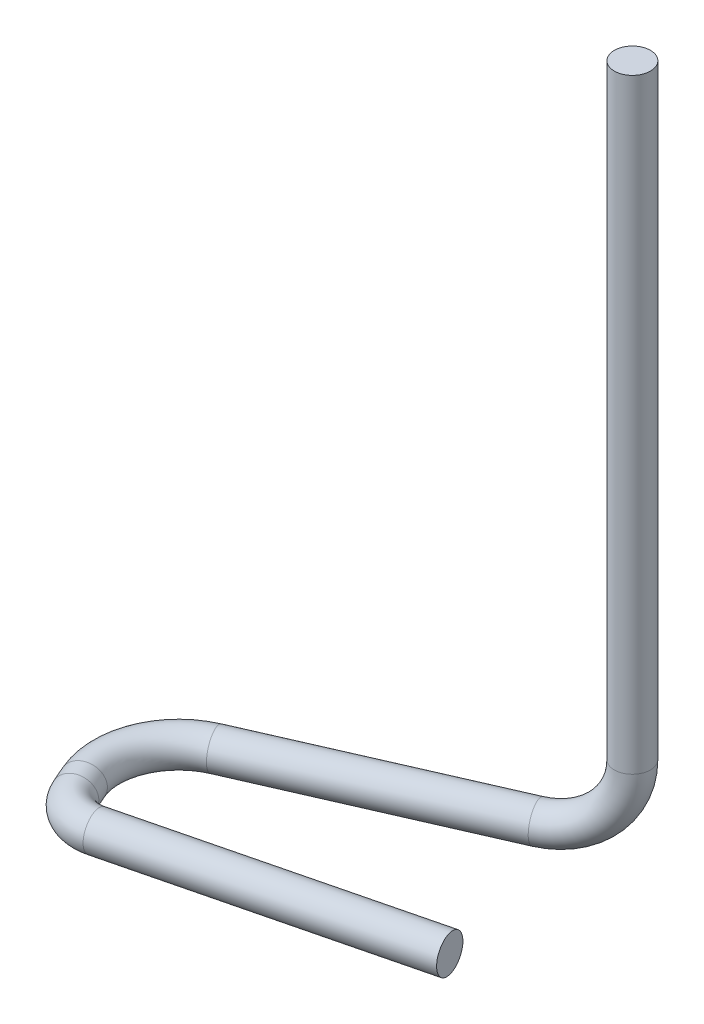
SolidWorks part; units mm, degrees
ref_plane "Plan de face" through (0, 0, 0) normal (0, 0, 1) x (1, 0, 0)
ref_plane "Plan de dessus" through (0, 0, 0) normal (0, 1, 0) x (1, 0, 0)
ref_plane "Plan de droite" through (0, 0, 0) normal (1, 0, 0) x (0, 0, -1)
sketch3d "Esquisse3D1"
  line L0 (4.5267, 6, 9.1161) -> (4.5267, -2.4, 9.1161)
  line L2 (3.6106, -3.4, 9.517) -> (0.5043, -3.4, 10.8762)
  line L3 (-0.0109, -3.4, 12.1932) -> (0.0821, -3.4, 12.4057)
  line L4 (0.6604, -3.4, 12.6906) -> (4.5922, -3.4, 11.7162)
  arc A0 (0.5043, -3.4, 10.8762) -> (-0.0109, -3.4, 12.1932) centre (0.9052, -3.4, 11.7923) ccw
  arc A1 (0.0821, -3.4, 12.4057) -> (0.6604, -3.4, 12.6906) centre (0.5401, -3.4, 12.2052) ccw
  arc A2 (4.5267, -2.4, 9.1161) -> (3.6106, -3.4, 9.517) centre (3.6106, -2.4, 9.517) ccw
  point P8 (-0.4118, -3.4, 11.277)
  point P9 (0.9052, -2.4, 11.7923)
  point P12 (0.2511, -3.4, 12.792)
  point P13 (0.5401, -2.9, 12.2052)
  point P16 (4.5267, -3.4, 9.1161)
  point P17 (3.2097, -2.4, 8.6008)
  dimension "D1" = 1
  dimension "D2" = 0.5
  dimension "D3" = 1
ref_plane "Plan1" through (4.5267, 6, 9.1161) normal (0, -1, 0) x (1, 0, 0)
sketch "Esquisse1" plane through (4.5267, 6, 9.1161) normal (0, -1, 0) x (1, 0, 0)
  circle A0 centre (0, 0) radius 0.25
sweep "Balayage1" add profiles "Esquisse1" path "Esquisse3D1"
